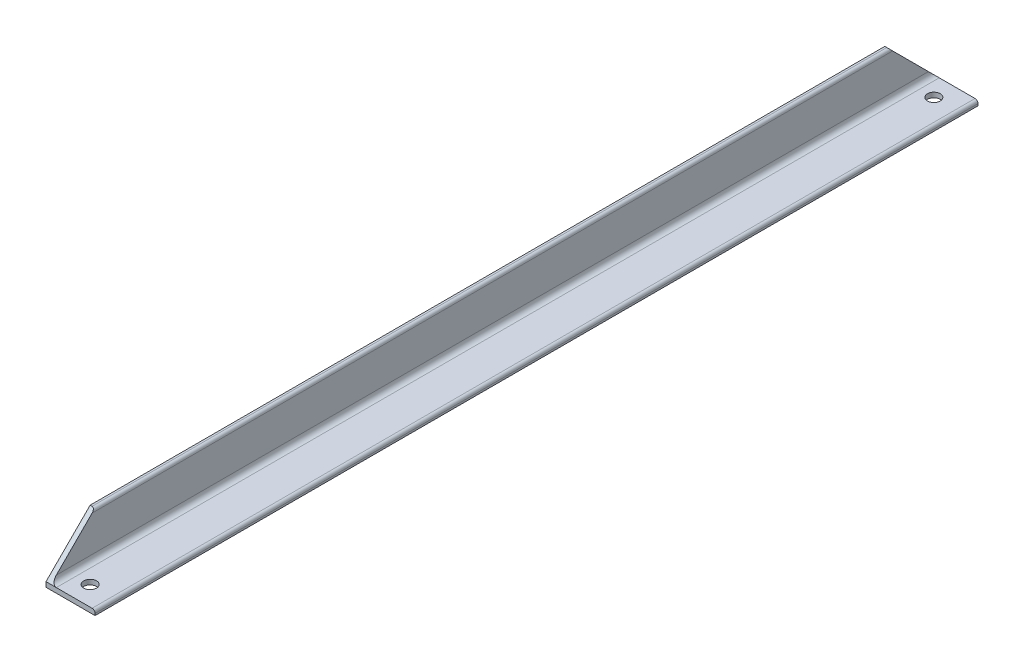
SolidWorks part; units mm, degrees
ref_plane "前视基准面" through (0, 0, 0) normal (0, 0, 1) x (1, 0, 0)
ref_plane "上视基准面" through (0, 0, 0) normal (0, 1, 0) x (1, 0, 0)
ref_plane "右视基准面" through (0, 0, 0) normal (1, 0, 0) x (0, 0, -1)
sketch "草图1" plane through (0, 0, 0) normal (0, 0, 1) x (1, 0, 0)
  line L0 (0, 50) -> (0, 0)
  line L1 (0, 0) -> (50, 0)
  line L2 (50, 0) -> (50, 2)
  line L3 (47, 5) -> (10.5, 5)
  line L4 (5, 10.5) -> (5, 47)
  line L5 (2, 50) -> (0, 50)
  arc A0 (10.5, 5) -> (5, 10.5) centre (10.5, 10.5) cw
  arc A1 (5, 47) -> (2, 50) centre (2, 47) ccw
  arc A2 (50, 2) -> (47, 5) centre (47, 2) ccw
  dimension "D5" = 5.5
  dimension "D6" = 3
  dimension "D1" = 50
  dimension "D2" = 50
  dimension "D3" = 5
  dimension "D4" = 5
extrude "拉伸1" add sketch "草图1" along normal mid plane 900
sketch "草图2" plane through (0, 0, 0) normal (-1, 0, 0) x (0, 0, 1)
  line L0 (450, 50) -> (405, 50)
  line L1 (450, 50) -> (-450, 50) construction
  line L2 (405, 50) -> (450, 5)
  line L3 (450, 50) -> (450, 0) construction
  line L4 (450, 5) -> (450, 50)
  line L5 (-450, 50) -> (-405, 50)
  line L6 (-405, 50) -> (-450, 5)
  line L7 (-450, 50) -> (-450, 0) construction
  line L8 (-450, 5) -> (-450, 50)
  dimension "D1" = 45
  dimension "D2" = 45
  dimension "D3" = 45
  dimension "D4" = 45
extrude "切除-拉伸1" cut sketch "草图2" against normal blind 920
sketch "草图3" plane through (0, 0, 0) normal (0, -1, 0) x (1, 0, 0)
  line L0 (0, 450) -> (50, 450) construction
  line L1 (0, -450) -> (50, -450) construction
  line L2 (50, 450) -> (50, -450) construction
  circle A0 centre (25, 430) radius 6.5
  circle A1 centre (25, -430) radius 6.5
  dimension "D1" = 20
  dimension "D2" = 20
  dimension "D3" = 25
  dimension "D4" = 25
  dimension "D5" = 13
  dimension "D6" = 13
extrude "切除-拉伸2" cut sketch "草图3" against normal blind 920
